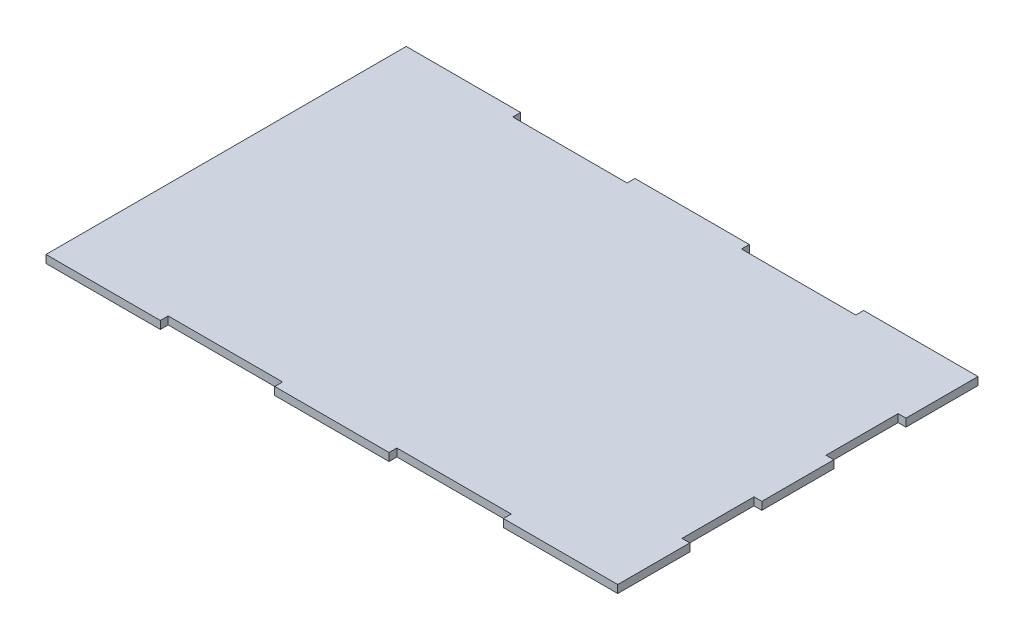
SolidWorks part; units mm, degrees
ref_plane "Front Plane" through (0, 0, 0) normal (0, 0, 1) x (1, 0, 0)
ref_plane "Top Plane" through (0, 0, 0) normal (0, 1, 0) x (1, 0, 0)
ref_plane "Right Plane" through (0, 0, 0) normal (1, 0, 0) x (0, 0, -1)
ref_plane "Plane1" through (0, 3.175, 0) normal (0, 1, 0) x (-1, 0, 0)
sketch "Sketch1" plane through (0, 3.175, 0) normal (0, 1, 0) x (-1, 0, 0)
  line L0 (-46.355, -146.05) -> (0, -146.05)
  line L1 (0, -146.05) -> (0, 0)
  line L2 (0, 0) -> (-46.355, 0)
  line L3 (-46.355, 0) -> (-46.355, -3.175)
  line L4 (-46.355, -3.175) -> (-92.71, -3.175)
  line L5 (-92.71, -3.175) -> (-92.71, 0)
  line L6 (-92.71, 0) -> (-139.065, 0)
  line L7 (-139.065, 0) -> (-139.065, -3.175)
  line L8 (-139.065, -3.175) -> (-185.42, -3.175)
  line L9 (-185.42, -3.175) -> (-185.42, 0)
  line L10 (-185.42, 0) -> (-231.775, 0)
  line L11 (-231.775, 0) -> (-231.775, -29.21)
  line L12 (-231.775, -29.21) -> (-228.6, -29.21)
  line L13 (-228.6, -29.21) -> (-228.6, -58.42)
  line L14 (-228.6, -58.42) -> (-231.775, -58.42)
  line L15 (-231.775, -58.42) -> (-231.775, -87.63)
  line L16 (-231.775, -87.63) -> (-228.6, -87.63)
  line L17 (-228.6, -87.63) -> (-228.6, -116.84)
  line L18 (-228.6, -116.84) -> (-231.775, -116.84)
  line L19 (-231.775, -116.84) -> (-231.775, -146.05)
  line L20 (-231.775, -146.05) -> (-185.42, -146.05)
  line L21 (-185.42, -146.05) -> (-185.42, -142.875)
  line L22 (-185.42, -142.875) -> (-139.065, -142.875)
  line L23 (-139.065, -142.875) -> (-139.065, -146.05)
  line L24 (-139.065, -146.05) -> (-92.71, -146.05)
  line L25 (-92.71, -146.05) -> (-92.71, -142.875)
  line L26 (-92.71, -142.875) -> (-46.355, -142.875)
  line L27 (-46.355, -142.875) -> (-46.355, -146.05)
  dimension "D1" = 3.175
  dimension "D2" = 46.355
  dimension "D3" = 92.71
  dimension "D4" = 139.065
  dimension "D5" = 185.42
  dimension "D6" = 231.775
  dimension "D7" = 3.175
  dimension "D8" = 29.21
  dimension "D9" = 58.42
  dimension "D10" = 87.63
  dimension "D11" = 116.84
  dimension "D12" = 142.875
  dimension "D13" = 146.05
extrude "Boss-Extrude1" add sketch "Sketch1" against normal blind 3.175
